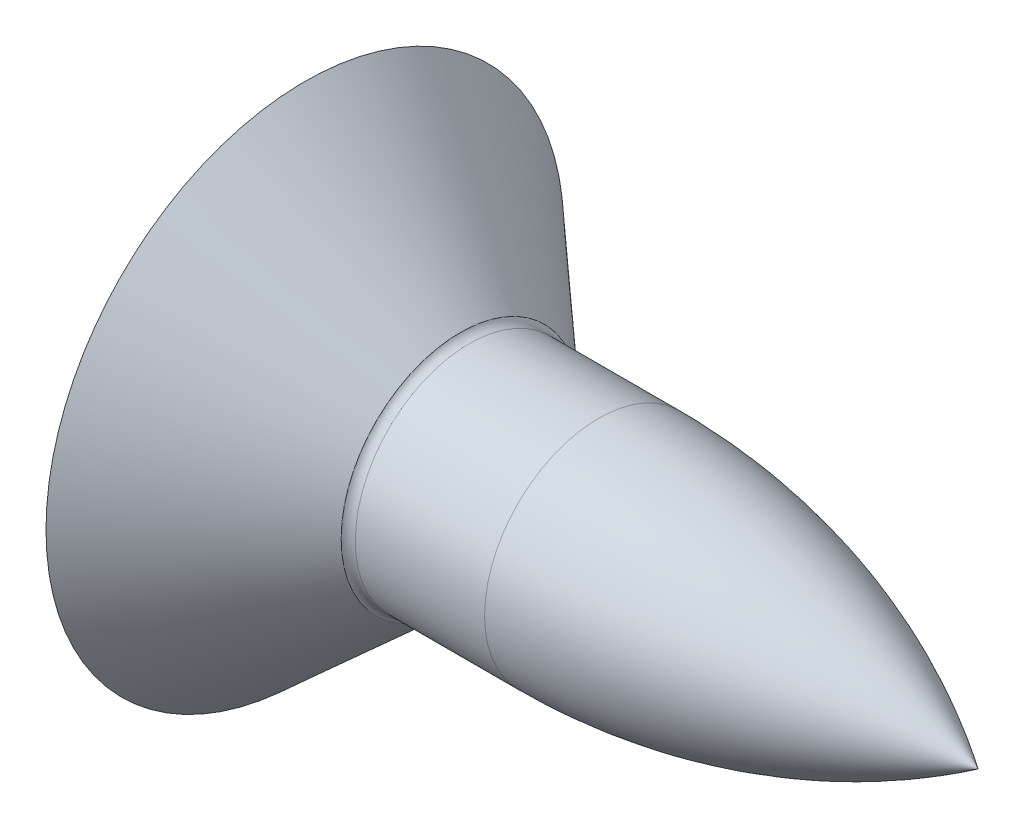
SolidWorks part; units mm, degrees
ref_plane "Plane1" through (0, 0, 0) normal (0, 0, 1) x (1, 0, 0)
ref_plane "Plane2" through (0, 0, 0) normal (0, 1, 0) x (1, 0, 0)
ref_plane "Plane3" through (0, 0, 0) normal (1, 0, 0) x (0, 0, -1)
sketch "BodySke" plane through (0, 0, 0) normal (0, 0, 1) x (1, 0, 0)
  line L0 (1.5, 1.1) -> (1.5, 1.15)
  line L1 (1.725, 6.35) -> (1.725, -3.175) construction
  line L2 (-25.4, 0) -> (127, 0) construction
  line L3 (6.5, 0) -> (0, 0)
  line L4 (1.5, 1.1) -> (2.8354, 1.1)
  line L5 (0, 0) -> (0, 2.5)
  line L6 (0, 2.5) -> (1.5, 1.15)
  line L8 (2.1, 6.35) -> (2.1, -3.175) construction
  arc A1 (6.5, 0) -> (2.8354, 1.1) centre (2.8354, -5.5544) ccw
  point P19 (1.5, 2.5)
  dimension "D3" = 0.05
  dimension "D1" = 1.1
  dimension "D2" = 5
  dimension "Head_ht" = 1.5
  dimension "Advance" = 0.45
revolve "Base-Revolve" add sketch "BodySke"
fillet "Fillet1" radius 0.1 1 edges at (1.5, 0, 1.1)
sketch "Sketch3" plane through (0, 0, 0) normal (1, 0, 0) x (0, 0, -1)
  line L0 (0.37, -1.3) -> (-0.37, -1.3)
  line L1 (0.37, -1.3) -> (0.37, 1.3)
  line L2 (-0.37, 1.3) -> (0.37, 1.3)
  line L3 (-0.37, 1.3) -> (-0.37, -1.3)
  dimension "D1" = 1.3
  dimension "Cross_dia" = 2.6
  dimension "D2" = 0.37
  dimension "Cross_width" = 0.74
ref_plane "Plane4" through (1.5, 0, 0) normal (1, 0, 0) x (0, 0, -1)
sketch "Sketch4" plane through (1.5, 0, 0) normal (1, 0, 0) x (0, 0, -1)
  line L0 (0.37, -0.5521) -> (-0.37, -0.5521)
  line L1 (0.37, -0.5521) -> (0.37, 0.5521)
  line L2 (-0.37, 0.5521) -> (0.37, 0.5521)
  line L3 (-0.37, 0.5521) -> (-0.37, -0.5521)
  dimension "D1" = 0.74
  dimension "D2" = 1.1043
  dimension "D3" = 0.37
  dimension "D4" = 0.5521
loft "Recess" cut profiles "Sketch3", "Sketch4"
pattern_circular "RecPat" count 2 every 90 about axis through (0, 0, 0) along (1, 0, 0) of "Recess"
sketch "RecCorSke" plane through (0, 0, 0) normal (0, 0, 1) x (1, 0, 0)
  line L0 (-3.175, 0) -> (15.875, 0) construction
  line L1 (-25.4, 0) -> (127, 0) construction
  line L2 (0, 0) -> (0, 0.6609)
  line L3 (0, 0.6609) -> (1.5, 0.556)
  line L4 (1.5, 0.556) -> (1.6807, 0)
  line L5 (1.6807, 0) -> (0, 0)
  dimension "Diameter" = 1.112
  dimension "Depth" = 1.5
  dimension "Draft_angle" = 4
  dimension "Bottom_angle" = 18
revolve "RecessCore" cut sketch "RecCorSke" angle 360 about L0
sketch "ThdSchSke" plane through (0, 0, 0) normal (0, 0, 1) x (1, 0, 0)
  line L0 (3, -0.9965) -> (2.8225, -1.25)
  line L1 (3, -0.9965) -> (3.1775, -1.25)
  line L2 (3.1775, -1.25) -> (3.1775, -1.5625)
  line L3 (-3.175, 0) -> (5.1513, 0) construction
  line L5 (3.1775, -1.5625) -> (2.8225, -1.5625)
  line L6 (2.8225, -1.5625) -> (2.8225, -1.25)
  dimension "Thread_minor" = 1.993
  dimension "Diameter" = 2.5
  dimension "Start" = 3
  dimension "SideAngle" = 55
  dimension "VeeAngle" = 70
  dimension "Overcut" = 3.125
revolve "ThreadSchematic" cut sketch "ThdSchSke" angle 360 about L3
pattern_linear "ThdSchPat"
